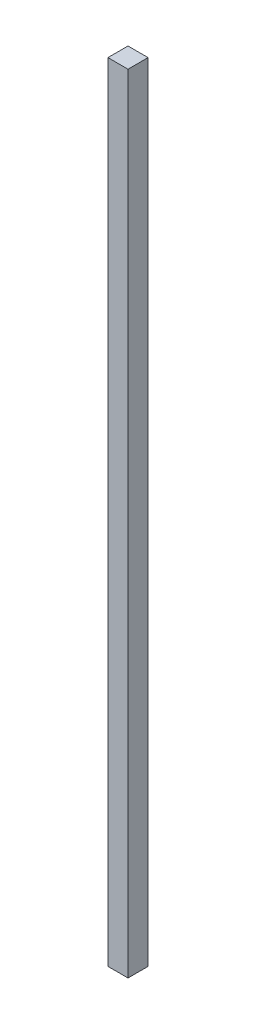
SolidWorks part; units mm, degrees
ref_plane "Plan de face" through (0, 0, 0) normal (0, 0, 1) x (1, 0, 0)
ref_plane "Plan de dessus" through (0, 0, 0) normal (0, 1, 0) x (1, 0, 0)
ref_plane "Plan de droite" through (0, 0, 0) normal (1, 0, 0) x (0, 0, -1)
sketch "Esquisse1" plane through (0, 0, 0) normal (0, 1, 0) x (1, 0, 0)
  line L1 (0, 0) -> (50, 0)
  line L2 (0, 0) -> (0, 50)
  line L3 (0, 50) -> (50, 50)
  line L4 (50, 0) -> (50, 50)
  dimension "D1" = 50
  dimension "D2" = 50
extrude "Extrusion1" add sketch "Esquisse1" along normal blind 1960
